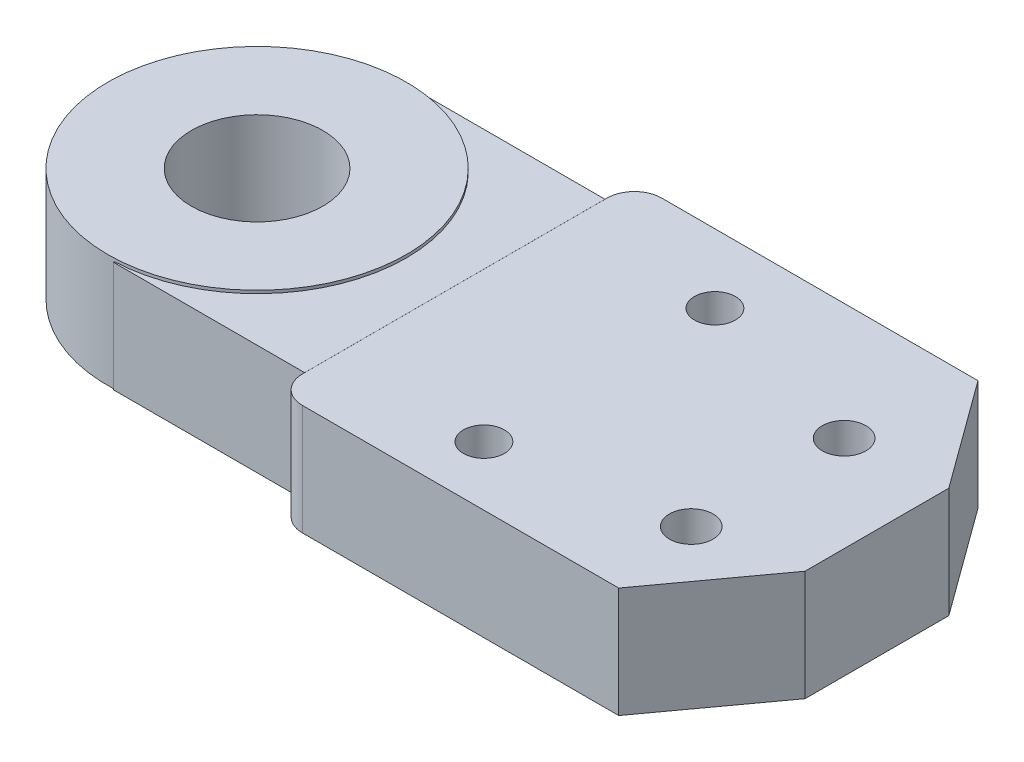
SolidWorks part; units mm, degrees
ref_plane "Front Plane" through (0, 0, 0) normal (0, 0, 1) x (1, 0, 0)
ref_plane "Top Plane" through (0, 0, 0) normal (0, 1, 0) x (1, 0, 0)
ref_plane "Right Plane" through (0, 0, 0) normal (1, 0, 0) x (0, 0, -1)
sketch "Sketch1" plane through (0, 0, 0) normal (0, 0, 1) x (1, 0, 0)
  line L1 (-18, -9) -> (18, -9)
  line L2 (-18, -9) -> (-18, 9)
  line L3 (-18, 9) -> (18, 9)
  line L4 (18, -9) -> (18, 9)
  line L5 (-18, -9) -> (18, 9) construction
  line L6 (-18, 9) -> (18, -9) construction
  point P0 (0, 0)
  dimension "D1" = 18
  dimension "D2" = 36
extrude "Boss-Extrude1" add sketch "Sketch1" along normal mid plane 25.4
sketch "Sketch2" plane through (0, 0, 0) normal (0, 1, 0) x (1, 0, 0)
  line L0 (-18, -12.7) -> (-18, 12.7) construction
  circle A0 centre (-18, 0) radius 25
  dimension "D1" = 50
extrude "Boss-Extrude2" add sketch "Sketch2" along normal mid plane 19
sketch "Sketch3" plane through (0, 9.5, 0) normal (0, 1, 0) x (1, 0, 0)
  line L0 (-18, 25) -> (-18, -25) construction
  line L1 (-43, 0) -> (7, 0) construction
  circle A0 centre (-18, 0) radius 25 construction
  arc A1 (3.5339, -12.7) -> (3.5339, 12.7) centre (-18, 0) ccw construction
  circle A2 centre (-18, 0) radius 11
  dimension "D1" = 22
extrude "Cut-Extrude1" cut sketch "Sketch3" against normal blind 33
sketch "Sketch4" plane through (0, 9, 0) normal (0, 1, 0) x (1, 0, 0)
  line L0 (18, 12.7) -> (3.5339, 12.7) construction
  line L1 (-0.902, 12.7) -> (-0.902, -12.7)
  line L2 (18, -12.7) -> (3.5339, -12.7) construction
  line L3 (-0.902, -12.7) -> (18, -12.7)
  line L4 (18, -12.7) -> (18, 12.7)
  line L5 (18, -12.7) -> (18, 12.7) construction
  line L6 (18, 12.7) -> (-0.902, 12.7)
extrude "Cut-Extrude2" cut sketch "Sketch4" against normal through all
scale "Scale1" scale about centroid uniform scaling yes scale factor 0.7
scale "Scale2" scale about centroid uniform scaling yes scale factor 0.5
scale "Scale3" scale about centroid uniform scaling yes scale factor 1.25
sketch "Sketch7" plane through (-11.89, 0, 0) normal (1, 0, 0) x (0, 0, -1)
  line L1 (-5.5562, 3.9542) -> (5.5563, 3.9542)
  line L2 (-5.5562, 3.9542) -> (-5.5562, -4.1396)
  line L3 (-5.5562, -4.1396) -> (5.5563, -4.1396)
  line L4 (5.5563, 3.9542) -> (5.5563, -4.1396)
extrude "Boss-Extrude4" add sketch "Sketch7" along normal blind 3
sketch "Sketch8" plane through (-8.89, 0, 0) normal (1, 0, 0) x (0, 0, -1)
  line L0 (0, 3.9542) -> (0, -4.1396) construction
  line L1 (-11, 3.9542) -> (11, 3.9542)
  line L2 (-11, 3.9542) -> (-11, -4.1396)
  line L3 (-11, -4.1396) -> (11, -4.1396)
  line L4 (11, 3.9542) -> (11, -4.1396)
  dimension "D1" = 11
extrude "Boss-Extrude5" add sketch "Sketch8" along normal blind 4
sketch "Sketch9" plane through (-8.89, 0, 0) normal (-1, 0, 0) x (0, 0, 1)
  line L0 (0, -5.3849) -> (0, 5.3849) construction
  line L1 (5.5563, 3.9542) -> (11, 3.9542)
  line L2 (5.5563, 3.9542) -> (5.5563, -4.1396)
  line L3 (5.5563, -4.1396) -> (11, -4.1396)
  line L4 (11, 3.9542) -> (11, -4.1396)
  line L5 (-5.5563, -4.1396) -> (-11, -4.1396)
  line L6 (-11, 3.9542) -> (-11, -4.1396)
  line L7 (-5.5563, 3.9542) -> (-11, 3.9542)
  line L8 (-5.5563, 3.9542) -> (-5.5563, -4.1396)
extrude "Boss-Extrude6" add sketch "Sketch9" along normal blind 10
sketch "Sketch10" plane through (0, -4.1396, 0) normal (0, -1, 0) x (1, 0, 0)
  line L0 (6.0525, -6.6124) -> (6.0525, 7.3088) construction
  line L1 (6.0525, 10.3088) -> (6.0525, 13.1568) construction
  line L2 (6.0525, 0) -> (-4.89, 0) construction
  line L3 (6.0525, 0) -> (19.0301, 0) construction
  line L4 (6.0525, -9.6124) -> (6.0525, -13.1568) construction
  line L6 (26.0303, 5.2665) -> (26.0303, -5.2665)
  line L7 (-4.89, -11) -> (-4.89, -11.1568)
  line L8 (-4.89, -11) -> (-18.89, -11) construction
  line L9 (19.0301, -3) -> (19.0301, 0) construction
  line L10 (19.0301, 0) -> (19.0301, 5) construction
  line L11 (19.0301, 0) -> (26.0303, 0) construction
  line L12 (20.279, -13.1568) -> (26.0303, -5.2665)
  line L14 (26.0303, 5.2665) -> (20.2768, 13.1568)
  line L18 (-4.89, 11) -> (-4.89, 11.1568)
  line L19 (-2.89, 13.1568) -> (20.2768, 13.1568)
  line L20 (-4.89, 11) -> (-4.89, -11) construction
  line L21 (-2.89, -13.1568) -> (20.279, -13.1568)
  line L22 (-4.89, 11) -> (-4.89, -11)
  circle A0 centre (6.0525, -8.1124) radius 1.5
  circle A1 centre (6.0525, 8.8088) radius 1.5
  circle A2 centre (19.0301, -4.6) radius 1.6
  circle A3 centre (19.0301, 6.6) radius 1.6
  arc A4 (-2.89, 13.1568) -> (-4.89, 11.1568) centre (-2.89, 11.1568) ccw
  arc A5 (-2.89, -13.1568) -> (-4.89, -11.1568) centre (-2.89, -11.1568) cw
  point P29 (-4.89, 13.1568)
  point P38 (-4.89, -13.1568)
  dimension "D4" = 3
  dimension "D5" = 3.5445
  dimension "D15" = 3.2
  dimension "D12" = 2
  dimension "D16" = 2
  dimension "D2" = 2.848
  dimension "D3" = 13.9212
  dimension "D6" = 2.1568
  dimension "D7" = 25.1668
  dimension "D8" = 7.0002
  dimension "D9" = 30.9203
  dimension "D10" = 3
  dimension "D11" = 5
  dimension "D13" = 10.9424
  dimension "D14" = 12.9777
  dimension "D17" = 9.7653
  dimension "D18" = 9.764
  dimension "D19" = 13.1568
extrude "Boss-Extrude7" add sketch "Sketch10" against normal blind 8.09
